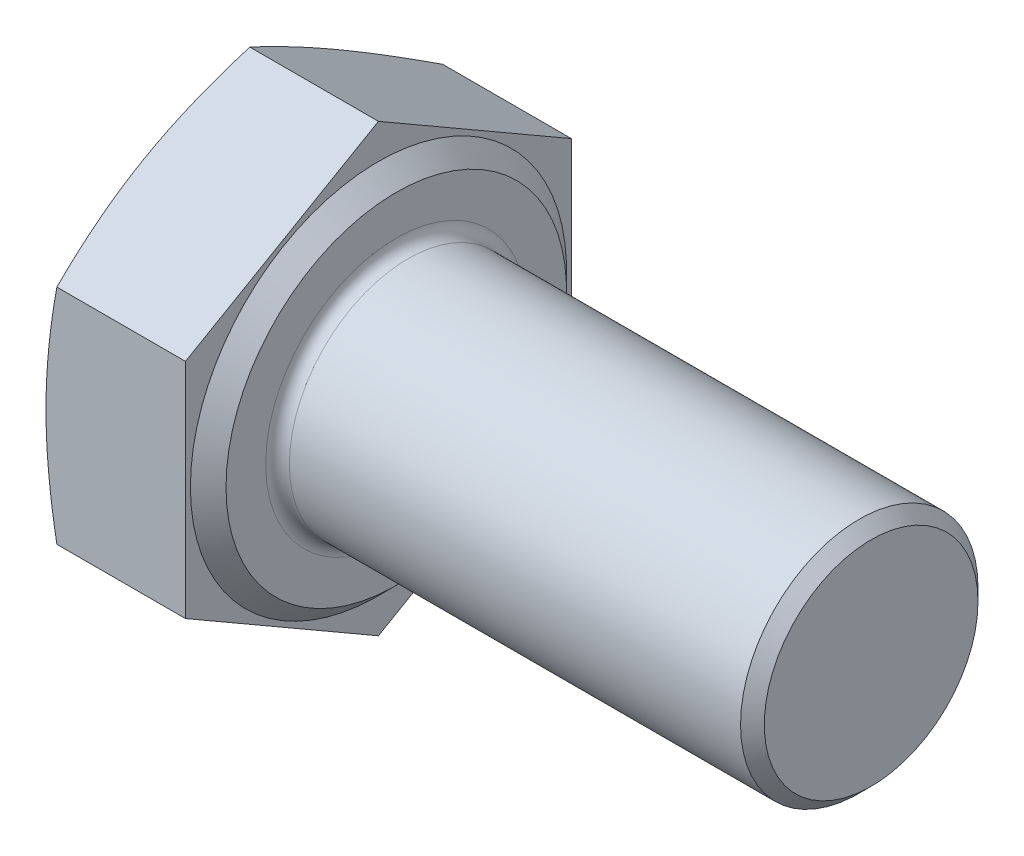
SolidWorks part; units mm, degrees
ref_plane "Front" through (0, 0, 0) normal (0, 0, 1) x (1, 0, 0)
ref_plane "Top" through (0, 0, 0) normal (0, 1, 0) x (1, 0, 0)
ref_plane "Right" through (0, 0, 0) normal (1, 0, 0) x (0, 0, -1)
sketch "Sketch2" plane through (0, 0, 0) normal (1, 0, 0) x (0, 0, -1)
  line L1 (0, -7.5056) -> (6.5, -3.7528)
  line L2 (6.5, -3.7528) -> (6.5, 3.7528)
  line L3 (6.5, 3.7528) -> (0, 7.5056)
  line L4 (0, 7.5056) -> (-6.5, 3.7528)
  line L5 (-6.5, 3.7528) -> (-6.5, -3.7528)
  line L6 (-6.5, -3.7528) -> (0, -7.5056)
  circle A0 centre (0, 0) radius 6.5 construction
  dimension "s" = 13
extrude "BaseHead" add sketch "Sketch2" along normal blind 5.3
sketch "Sketch3" plane through (0, 0, 0) normal (0, 0, 1) x (1, 0, 0)
  line L0 (5.3, 7.5056) -> (5.3, 5.735)
  line L2 (5.3, 5.735) -> (4.7, 6.335)
  line L3 (4.7, 6.335) -> (4.7, 7.5056)
  line L5 (4.7, 7.5056) -> (5.3, 7.5056)
  line L6 (-0.9571, 0) -> (7.6478, 0) construction
  line L7 (5.3, 7.5056) -> (0, 7.5056) construction
  dimension "D1" = 45
  dimension "c" = 0.6
  dimension "dw" = 11.47
revolve "BearingFace" cut sketch "Sketch3" angle 360 about L6
sketch "Sketch4" plane through (0, 0, 0) normal (0, 0, 1) x (1, 0, 0)
  line L0 (-0.4935, 0) -> (3.5626, 0) construction
  line L2 (0, 7.5056) -> (0.366, 7.5056)
  line L4 (0.366, 7.5056) -> (0, 6.5)
  line L6 (0, 6.5) -> (0, 7.5056)
  line L7 (4.7, 7.5056) -> (0, 7.5056) construction
  dimension "D1" = 20
  dimension "D2" = 13
revolve "HeadChamfer" cut sketch "Sketch4" angle 360 about L0
sketch "Sketch5" plane through (5.3, 0, 0) normal (1, 0, 0) x (0, 0, -1)
  circle A0 centre (0, 0) radius 4
  dimension "d" = 8
extrude "BaseBody" add sketch "Sketch5" along normal blind 16
chamfer "Chamfer1" distance 0.4 angle 45 1 edges at (21.3, 0, -4)
fillet "HeadFillet" radius 0.4 1 edges at (5.3, 0, -4)
equation "\"D2@Sketch4\" = \"s@Sketch2\""
equation "\"D1@Chamfer1\" = 0.05 * \"d@Sketch5\""
